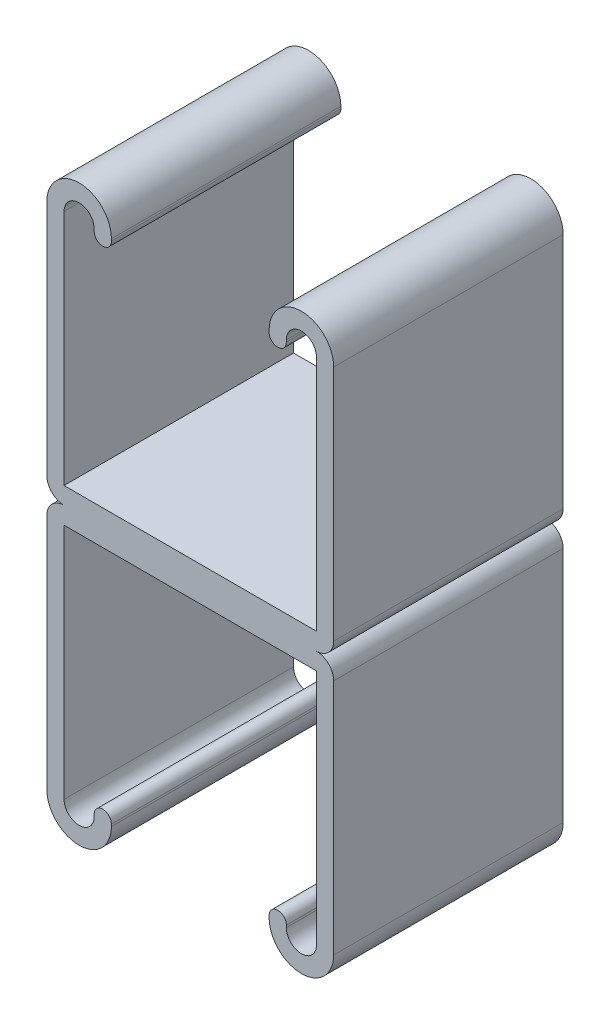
SolidWorks part; units mm, degrees
ref_plane "Plane1" through (0, 0, 0) normal (0, 0, 1) x (1, 0, 0)
ref_plane "Plane2" through (0, 0, 0) normal (0, 1, 0) x (1, 0, 0)
ref_plane "Plane3" through (0, 0, 0) normal (1, 0, 0) x (0, 0, -1)
sketch "Sketch1" plane through (0, 0, 0) normal (0, 0, 1) x (1, 0, 0)
  line L0 (-15.875, 28.1781) -> (-15.875, 1.905)
  line L1 (-13.97, 0) -> (13.97, 0)
  line L2 (15.875, 1.905) -> (15.875, 28.1781)
  line L3 (8.7312, 28.1781) -> (8.7312, 27.94)
  line L4 (-8.7313, 28.1781) -> (-8.7313, 27.94)
  line L5 (-10.6363, 28.1781) -> (-10.6363, 27.94)
  line L6 (-13.97, 28.1781) -> (-13.97, 1.905)
  line L7 (-13.97, 1.905) -> (13.97, 1.905)
  line L8 (13.97, 1.905) -> (13.97, 28.1781)
  line L9 (10.6362, 28.1781) -> (10.6362, 27.94)
  line L10 (-25.4, 31.75) -> (25.4, 31.75) construction
  line L11 (-12.8524, 26.9875) -> (12.8524, 26.9875) construction
  arc A0 (15.875, 28.1781) -> (8.7312, 28.1781) centre (12.3031, 28.1781) ccw
  arc A1 (-15.875, 28.1781) -> (-8.7313, 28.1781) centre (-12.3031, 28.1781) cw
  arc A2 (-13.97, 0) -> (-15.875, 1.905) centre (-13.97, 1.905) cw
  arc A3 (13.97, 0) -> (15.875, 1.905) centre (13.97, 1.905) ccw
  arc A4 (-13.97, 28.1781) -> (-10.6363, 28.1781) centre (-12.3031, 28.1781) cw
  arc A5 (13.97, 28.1781) -> (10.6362, 28.1781) centre (12.3031, 28.1781) ccw
  arc A6 (8.7312, 27.94) -> (10.6362, 27.94) centre (9.6837, 27.94) ccw
  arc A7 (-8.7313, 27.94) -> (-10.6363, 27.94) centre (-9.6838, 27.94) cw
  dimension "D1" = 1.905
  dimension "D3" = 15.875
  dimension "Width" = 31.75
  dimension "D6" = 7.1437
  dimension "D7" = 17.4625
  dimension "D8" = 31.75
  dimension "D9" = 4.7625
  dimension "gauge" = 1.905
extrude "Base-Extrude" add sketch "Sketch1" along normal mid plane 25.4
mirror "Mirror1" about plane through (0, 0, 0) normal (0, 1, 0) of "Base-Extrude"
equation "\"D3@Sketch1\" = \"Width@Sketch1\" / 2"
equation "\"D7@Sketch1\" = \"Width@Sketch1\" - 2 * \"D6@Sketch1\""
equation "\"D1@Sketch1\" = \"gauge@Sketch1\""
